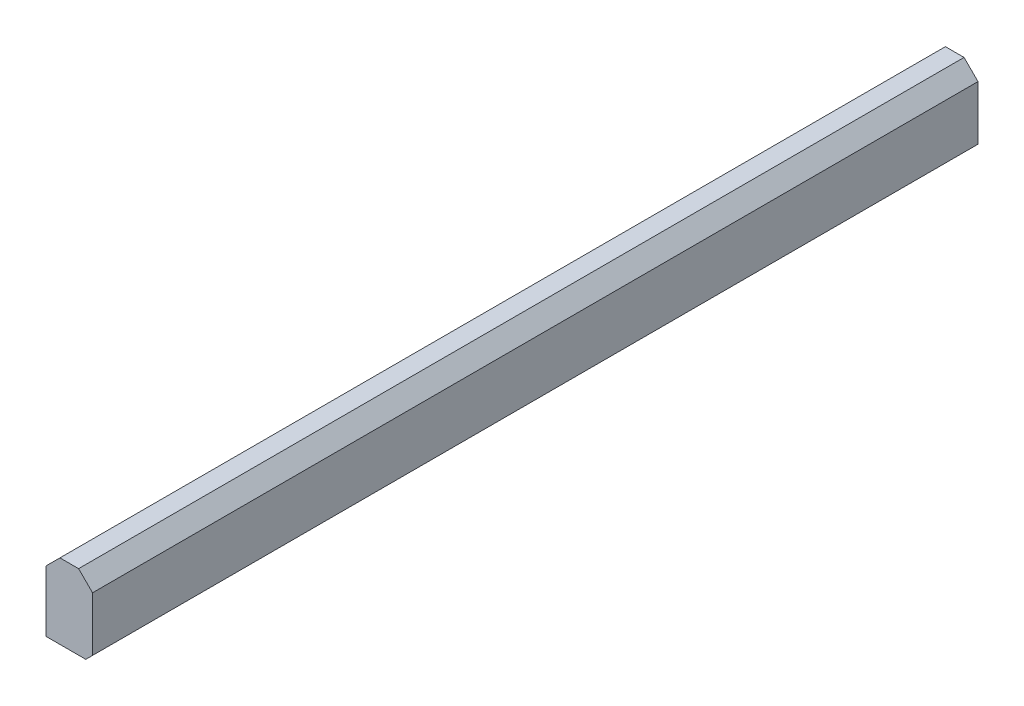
SolidWorks part; units mm, degrees
ref_plane "Front Plane" through (0, 0, 0) normal (1, 0, 0) x (0, 1, 0)
ref_plane "Top Plane" through (0, 0, 0) normal (0, 0, 1) x (0, 1, 0)
ref_plane "Right Plane" through (0, 0, 0) normal (0, 1, 0) x (-1, 0, 0)
sketch "sk w193" plane through (0, 0, 0) normal (0, 0, 1) x (0, 1, 0)
  point P0 (-199.517, -196.596)
  point P2 (0, -196.596)
  point P3 (11.303, 0)
  line B0 (-199.517, -196.596) -> (-199.517, -160.02)
  line B1 (-199.517, -160.02) -> (-26.543, -160.02)
  line B2 (-11.303, -144.78) -> (-11.303, 144.78)
  line B3 (-26.543, 160.02) -> (-199.517, 160.02)
  line B4 (-199.517, 160.02) -> (-199.517, 196.596)
  line B5 (-199.517, 196.596) -> (199.517, 196.596)
  line B6 (199.517, 196.596) -> (199.517, 160.02)
  line B7 (199.517, 160.02) -> (26.543, 160.02)
  line B8 (11.303, 144.78) -> (11.303, -144.78)
  line B9 (26.543, -160.02) -> (199.517, -160.02)
  line B10 (199.517, -160.02) -> (199.517, -196.596)
  line B11 (199.517, -196.596) -> (-199.517, -196.596)
  arc B12 (-26.543, -160.02) -> (-11.303, -144.78) centre (-26.543, -144.78) ccw
  arc B13 (-11.303, 144.78) -> (-26.543, 160.02) centre (-26.543, 144.78) ccw
  arc B14 (26.543, 160.02) -> (11.303, 144.78) centre (26.543, 144.78) ccw
  arc B15 (11.303, -144.78) -> (26.543, -160.02) centre (26.543, -144.78) ccw
sketch_block_instance "w14x193-2"
sketch_block "w14x193" parameters "D4"=15.24, "D1"=399.034, "D2"=393.192, "D3"=22.606, "D5"=36.576
sketch "Sketch2" plane through (0, 0, 0) normal (0, 0, 1) x (0, 1, 0)
  line L1 (-94.107, 58.42) -> (94.107, 58.42)
  line L2 (-94.107, 58.42) -> (-94.107, -58.42)
  line L3 (-94.107, -58.42) -> (94.107, -58.42)
  line L4 (94.107, 58.42) -> (94.107, -58.42)
  line L5 (-94.107, 58.42) -> (94.107, -58.42) construction
  line L6 (-94.107, -58.42) -> (94.107, 58.42) construction
  point P0 (0, 0)
  dimension "D1" = 116.84
  dimension "D2" = 188.214
extrude "Boss-Extrude1" add sketch "Sketch2" along normal mid plane 2222.714
chamfer "Chamfer1" distance 17 angle 45 1 edges at (58.42, -94.107, 0)
chamfer "Chamfer2" distance 35 angle 45 2 edges at (-58.42, 94.107, 0) (58.42, 94.107, 0)
